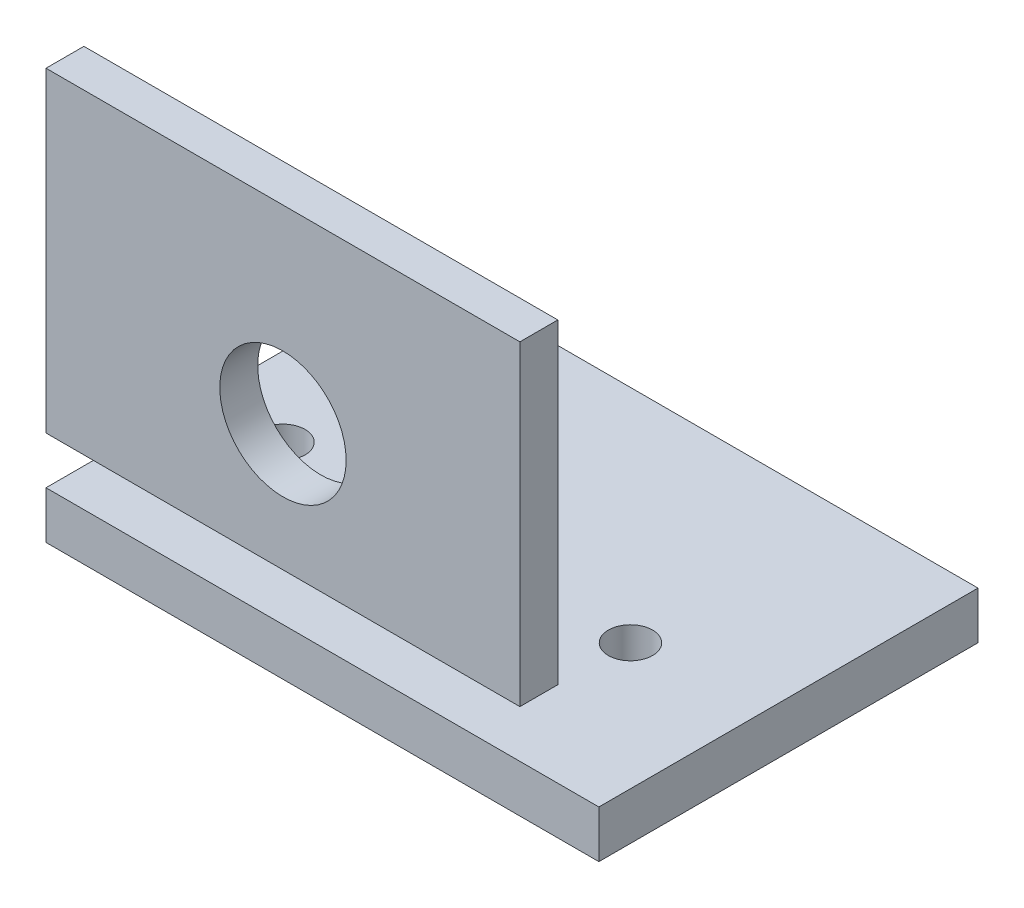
SolidWorks part; units mm, degrees
ref_plane "前视基准面" through (0, 0, 0) normal (0, 0, 1) x (1, 0, 0)
ref_plane "上视基准面" through (0, 0, 0) normal (0, 1, 0) x (1, 0, 0)
ref_plane "右视基准面" through (0, 0, 0) normal (1, 0, 0) x (0, 0, -1)
other "Configuration Table"
sketch "BaseSketch" plane through (0, 0, 0) normal (0, 1, 0) x (1, 0, 0)
  line L1 (0, 0) -> (175, 0)
  line L2 (0, 0) -> (0, 120)
  line L3 (0, 120) -> (175, 120)
  line L4 (175, 0) -> (175, 120)
  dimension "D1" = 175
  dimension "D2" = 120
extrude "BaseBoss" add sketch "BaseSketch" against normal blind 15
sketch "MountHolesSketch" plane through (0, 0, 0) normal (0, 1, 0) x (1, 0, 0)
  line L0 (25, 50) -> (135, 50) construction
  circle A0 centre (25, 50) radius 7
  circle A1 centre (135, 50) radius 7
  dimension "D2" = 14
  dimension "D3" = 14
  dimension "D1" = 110
extrude "MountHolesCut" cut sketch "MountHolesSketch" against normal blind 15
sketch "UprightSketch" plane through (0, 0, 0) normal (0, 0, 1) x (1, 0, 0)
  line L1 (0, 15) -> (150, 15)
  line L2 (0, 15) -> (0, 115)
  line L3 (0, 115) -> (150, 115)
  line L4 (150, 15) -> (150, 115)
  dimension "D1" = 100
extrude "UprightBoss" add sketch "UprightSketch" against normal blind 12
sketch "ShaftBoreSketch" plane through (0, 0, 0) normal (0, 0, 1) x (1, 0, 0)
  circle A0 centre (75, 55) radius 20
  dimension "D1" = 40
extrude "ShaftBoreCut" cut sketch "ShaftBoreSketch" against normal blind 12
